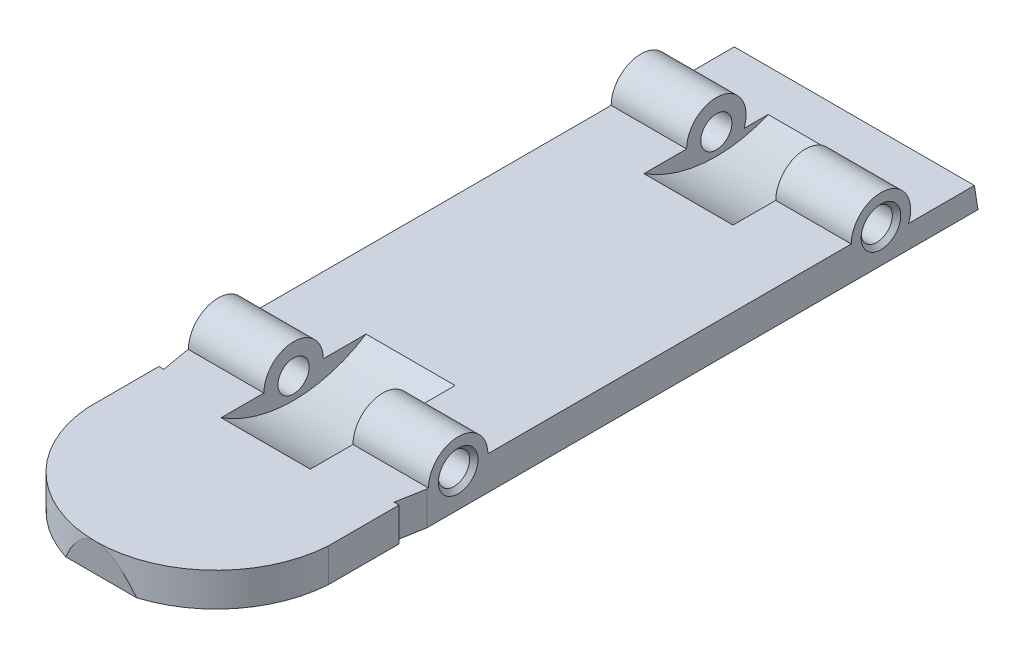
SolidWorks part; units mm, degrees
ref_plane "Front Plane" through (0, 0, 0) normal (0, 0, 1) x (1, 0, 0)
ref_plane "Top Plane" through (0, 0, 0) normal (0, 1, 0) x (1, 0, 0)
ref_plane "Right Plane" through (0, 0, 0) normal (1, 0, 0) x (0, 0, -1)
sketch "Sketch1" plane through (0, 0, 0) normal (1, 0, 0) x (0, 0, -1)
  line L0 (-1.524, 0) -> (-20.1676, 0) construction
  line L1 (-33.8524, -1.7272) -> (4.9797, -1.7272)
  line L2 (4.7061, 0) -> (4.9797, -1.7272)
  line L3 (1.524, 0) -> (4.7061, 0)
  line L4 (-33.8524, -1.7272) -> (-34.1259, 0)
  line L5 (-34.1259, 0) -> (-23.2156, 0)
  line L6 (-20.1676, 0) -> (-1.524, 0)
  circle A0 centre (0, 0) radius 0.8001
  circle A1 centre (-21.6916, 0) radius 0.8001
  arc A2 (-20.1676, 0) -> (-23.2156, 0) centre (-21.6916, 0) ccw
  arc A3 (1.524, 0) -> (-1.524, 0) centre (0, 0) ccw
  dimension "D1" = 1.6002
  dimension "D5" = 3.048
  dimension "D2" = 21.6916
  dimension "D3" = 1.7272
  dimension "D4" = 81
  dimension "D6" = 38.354
  dimension "D7" = 1.7272
extrude "Boss-Extrude1" add sketch "Sketch1" along normal mid plane 12.319
sketch "Sketch2" plane through (6.1595, 0, 0) normal (1, 0, 0) x (0, 0, -1)
  line L0 (4.7061, 0) -> (1.524, 0) construction
  line L1 (4.7061, 0) -> (1.524, 0)
  line L2 (4.7946, -0.5588) -> (1.4179, -0.5588)
  line L3 (4.9797, -1.7272) -> (4.7061, 0) construction
  line L4 (-33.8524, -1.7272) -> (4.9797, -1.7272) construction
  line L5 (4.7946, -0.5588) -> (4.7061, 0)
  arc A0 (1.4179, -0.5588) -> (1.524, 0) centre (0, 0) ccw
  arc A1 (1.524, 0) -> (-1.524, 0) centre (0, 0) ccw construction
  dimension "D1" = 1.1684
extrude "Cut-Extrude1" cut sketch "Sketch2" against normal through all
sketch "Sketch3" plane through (0, 0, 0) normal (0, 1, 0) x (1, 0, 0)
  line L0 (6.1595, -34.1259) -> (-6.1595, -34.1259) construction
  line L1 (-6.1595, -23.2156) -> (-6.1595, -34.1259) construction
  line L2 (-6.1595, -28.3495) -> (-6.1595, -34.1259)
  line L3 (6.1595, -23.2156) -> (6.1595, -34.1259) construction
  line L4 (6.1595, -34.1259) -> (-6.1595, -34.1259)
  line L5 (6.1595, -28.3495) -> (6.1595, -34.1259)
  arc A0 (-6.1595, -28.3495) -> (6.1595, -28.3495) centre (0, -27.9537) ccw
  dimension "D1" = 12.3444
extrude "Cut-Extrude2" cut sketch "Sketch3" against normal blind 12.319 contours A0 L2 L4 | A0 L4 L5
sketch "Sketch4" plane through (0, 0, 0) normal (1, 0, 0) x (0, 0, -1)
  line L0 (-21.6916, 0) -> (-21.6916, 11.4533) construction
  line L1 (0, 0) -> (0, 11.4533) construction
  circle A0 centre (-21.6916, 5.7635) radius 6.858
  circle A1 centre (0, 5.7635) radius 6.858
  dimension "D1" = 13.716
extrude "Cut-Extrude3" cut sketch "Sketch4" against normal mid plane 4.572
sketch "Sketch5" plane through (0, -1.7272, 0) normal (0, -1, 0) x (1, 0, 0)
  line L1 (-9.0263, 24.7279) -> (-5.2622, 24.7279) construction
  line L2 (5.9055, 24.7279) -> (5.9055, 22.0632) construction
  line L3 (6.1595, 28.3495) -> (6.1595, -4.9797) construction
  line L4 (5.2622, 24.7279) -> (6.9572, 24.7279) construction
  line L5 (6.1595, 23.2874) -> (5.9055, 24.7279)
  line L7 (6.1595, 24.7279) -> (6.1595, 23.2874)
  line L8 (5.9055, 24.7279) -> (6.1595, 24.7279)
  line L10 (-5.9055, 24.7279) -> (-6.1595, 24.7279)
  line L11 (-6.1595, 24.7279) -> (-6.1595, 23.2874)
  line L12 (-6.1595, 23.2874) -> (-5.9055, 24.7279)
  dimension "D2" = 0.254
  dimension "D3" = 10
extrude "Cut-Extrude4" cut sketch "Sketch5" against normal blind 4.572
sketch "Sketch6" plane through (6.1595, 0, 0) normal (1, 0, 0) x (0, 0, -1)
  circle A0 centre (-21.6916, 0) radius 1.016
  circle A1 centre (0, 0) radius 1.016
  dimension "D1" = 2.032
sketch3d "3DSketch1"
  line L0 (6.1595, 0, 21.6916) -> (6.1595, 1.8453, 21.6916) construction
  line L1 (6.1595, 0, 21.6916) -> (2.286, 0, 21.6916) construction
  line L2 (6.1595, 1.8453, 21.6916) -> (4.9197, 1.8453, 21.6916) construction
ref_plane "Plane1" through (0, 0, 21.6916) normal (0, 0, 1) x (1, 0, 0)
sketch "Sketch7" plane through (0, 0, 21.6916) normal (0, 0, 1) x (1, 0, 0)
  line L0 (6.1595, 1.0161) -> (5.9682, 0.8248)
  line L1 (6.1595, 0) -> (6.1595, 1.8453) construction
sketch "Sketch8" plane through (6.1595, 0, 0) normal (1, 0, 0) x (0, 0, -1)
  circle A0 centre (-21.6916, 0) radius 1.016 construction
  circle A1 centre (-21.6916, 0) radius 1.016
sketch "Sketch9" plane through (0, 0, 21.6916) normal (0, 0, 1) x (1, 0, 0)
  line L0 (6.1595, 0.8001) -> (2.286, 0.8001) construction
  line L1 (6.1595, 0.8001) -> (5.9435, 0.8001)
  line L2 (6.1595, 1.0161) -> (5.9682, 0.8248) construction
  line L3 (6.1595, 1.0161) -> (5.9435, 0.8001)
  line L4 (6.1595, -1.016) -> (6.1595, 1.016) construction
  line L5 (6.1595, 0) -> (4.9574, 0) construction
  line L6 (6.1595, 0.8001) -> (6.1595, 1.0161)
revolve "Cut-Revolve1" cut sketch "Sketch9" angle 360 about L5
mirror "Mirror1" about plane through (0, 0, 0) normal (1, 0, 0) of "Cut-Revolve1"
sketch3d "3DSketch2"
  line L1 (6.0515, 0, 10.8458) -> (-1.8244, 0, 10.8458) construction
  line L2 (-1.8244, 0, 10.8458) -> (-1.8244, 3.6058, 10.8458) construction
ref_plane "Plane2" through (0, 0, 10.8458) normal (0, 0, 1) x (1, 0, 0)
mirror "Mirror2" about plane through (0, 0, 10.8458) normal (0, 0, 1) of "Mirror1", "Cut-Revolve1"
